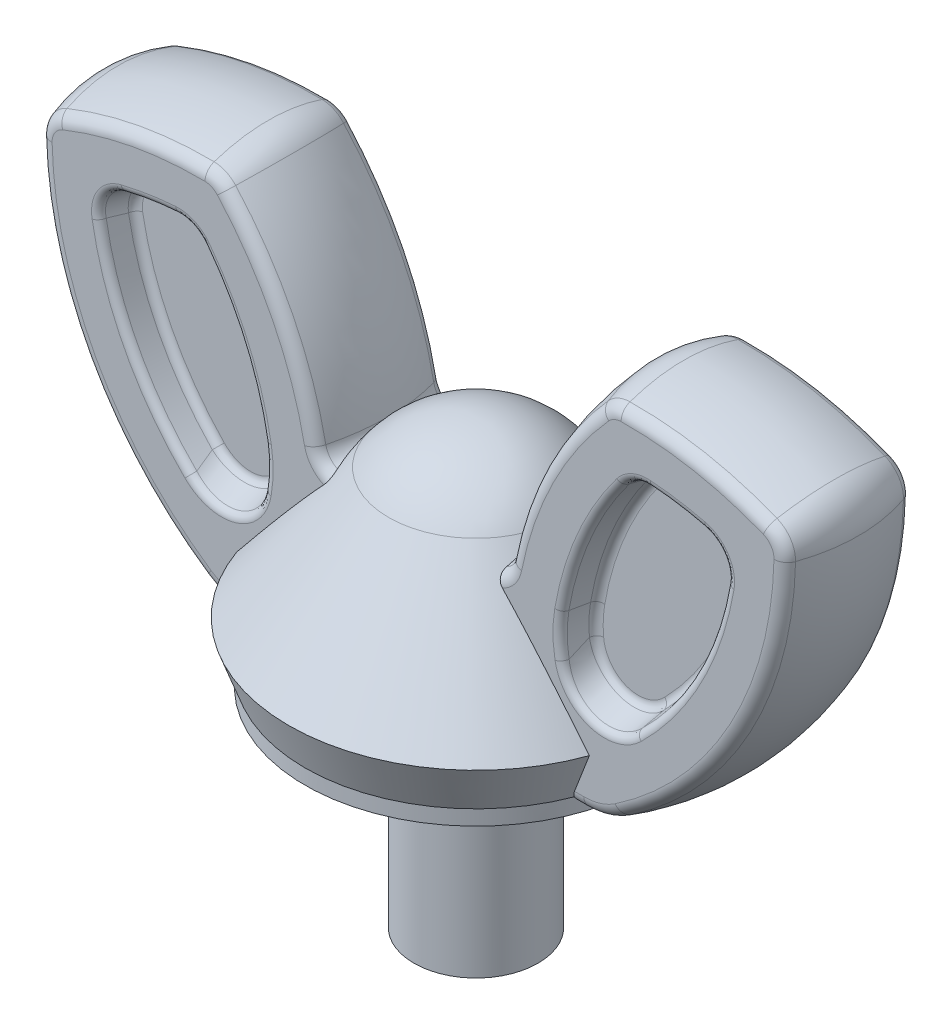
SolidWorks part; units mm, degrees
ref_plane "Front Plane" through (0, 0, 0) normal (0, 0, 1) x (1, 0, 0)
ref_plane "Top Plane" through (0, 0, 0) normal (0, 1, 0) x (1, 0, 0)
ref_plane "Right Plane" through (0, 0, 0) normal (1, 0, 0) x (0, 0, -1)
other "Configuration Table"
sketch "Sketch1" plane through (0, 0, 0) normal (0, 0, 1) x (1, 0, 0)
  line L0 (0, 10.7344) -> (0, 0) construction
  line L5 (4.826, 0) -> (-4.826, 0)
  line L6 (2.413, 5.08) -> (-2.413, 5.08)
  arc A11 (-2.413, 5.08) -> (-5.3975, 10.9034) centre (-13.1787, 3.2391) ccw
  arc A13 (-5.3975, 10.9034) -> (-10.795, 9.8298) centre (-6.0342, 0) ccw
  arc A24 (-10.795, 9.8298) -> (-6.0486, 0.3742) centre (0, 9.3295) ccw
  arc A26 (-4.826, 0) -> (-6.0486, 0.3742) centre (-4.826, 2.1844) cw
  arc A29 (4.826, 0) -> (6.0486, 0.3742) centre (4.826, 2.1844) ccw
  arc A34 (10.795, 9.8298) -> (6.0486, 0.3742) centre (0, 9.3295) cw
  arc A36 (5.3975, 10.9034) -> (10.795, 9.8298) centre (6.0342, 0) cw
  arc A37 (2.413, 5.08) -> (5.3975, 10.9034) centre (13.1787, 3.2391) cw
  point P19 (0, 0)
  point P27 (0, 5.08)
  point P29 (0, 5.08)
  point P44 (0, 5.08)
extrude "Extrude1" add sketch "Sketch1" along normal mid plane 3.556
fillet "Fillet4" radius 1.0922 4 edges at (10.795, 9.8298, 0) (5.3975, 10.9034, 0) (-5.3975, 10.9034, 0) (-10.795, 9.8298, 0)
sketch "Sketch2" plane through (0, 0, 1.778) normal (0, 0, 1) x (1, 0, 0)
  line L0 (0, 0) -> (0, 12.8329) construction
  line L1 (-4.826, 0) -> (4.826, 0) construction
  arc A10 (-4.1864, 4.7767) -> (-5.0416, 1.8652) centre (-7.5893, 4.1949) cw
  arc A11 (4.1864, 4.7767) -> (6.2055, 9.1212) centre (13.1787, 3.2391) cw
  arc A12 (6.2055, 9.1212) -> (8.9805, 8.634) centre (6.0342, 0) cw
  arc A13 (8.9805, 8.634) -> (5.0416, 1.8652) centre (0, 9.3295) cw
  arc A14 (4.1864, 4.7767) -> (5.0416, 1.8652) centre (7.5893, 4.1949) ccw
  arc A15 (-8.9805, 8.634) -> (-5.0416, 1.8652) centre (0, 9.3295) ccw
  arc A16 (-6.2055, 9.1212) -> (-8.9805, 8.634) centre (-6.0342, 0) ccw
  arc A17 (-4.1864, 4.7767) -> (-6.2055, 9.1212) centre (-13.1787, 3.2391) ccw
  arc A18 (-8.9805, 8.634) -> (-5.0416, 1.8652) centre (0, 9.3295) ccw
  arc A19 (-6.2055, 9.1212) -> (-8.9805, 8.634) centre (-6.0342, 0) ccw
  arc A20 (-4.1864, 4.7767) -> (-6.2055, 9.1212) centre (-13.1787, 3.2391) ccw
extrude "Cut-Extrude1" cut sketch "Sketch2" against normal blind 0.889 draft 10
fillet "Fillet1" radius 0.889 4 edges
fillet "Fillet6" radius 1.2446 2 edges
fillet "Fillet5" radius 0.3641 2 edges at (2.413, 5.08, 0) (-2.413, 5.08, 0)
fillet "Fillet3" radius 0.2223 28 edges at (7.4585, 9.011, 1.778) (7.4007, 8.8613, 0.889) (6.4621, 8.9114, 0.889) (8.6146, 8.3041, 0.889) (7.8855, 5.3103, 0.889) (4.2988, 4.3764, 0.889) (6.1282, 8.9579, 1.778) (8.7221, 8.5339, 1.778) (7.9776, 5.1471, 1.778) (4.1377, 4.1292, 1.778) (-4.2988, 4.3764, 0.889) (-7.8855, 5.3103, 0.889) (-8.5332, 8.4279, 0.889) (-7.4007, 8.8613, 0.889) (-6.1942, 8.7899, 0.889) (-4.1377, 4.1292, 1.778) (-7.9776, 5.1471, 1.778) (-8.7866, 8.4358, 1.778) (-7.4585, 9.011, 1.778) (-6.3795, 9.0717, 1.778) (4.9351, 6.7652, 0.889) (4.81, 6.8709, 1.778) (-4.9351, 6.7652, 0.889) (-4.81, 6.8709, 1.778) (4.9742, 2.938, 0.889) (5.0791, 2.5366, 1.778) (-5.2102, 2.8514, 0.889) (-5.0131, 2.5568, 1.778)
mirror "Mirror1" about plane through (0, 0, 0) normal (0, 0, 1) of "Fillet6", "Fillet3", "Fillet1", "Cut-Extrude1"
sketch "Sketch4" plane through (0, 0, 0) normal (1, 0, 0) x (0, 0, -1)
  line L1 (-1.778, 5.334) -> (1.778, 5.334)
  line L2 (-1.778, 4.4704) -> (-1.778, 5.334)
  line L4 (1.778, 0.3742) -> (1.778, 9.0918) construction
  line L6 (-1.778, 9.0918) -> (-1.778, 0.3742) construction
  line L7 (0, 5.715) -> (0, 0.381) construction
  line L9 (1.778, 4.4704) -> (1.778, 5.334)
  line L10 (-1.778, 5.08) -> (1.778, 5.08) construction
  arc A0 (-1.524, 4.826) -> (-1.778, 4.4704) centre (-1.4021, 4.4704) ccw
  arc A1 (1.524, 4.826) -> (-1.524, 4.826) centre (0, 0.381) ccw
  arc A2 (1.524, 4.826) -> (1.778, 4.4704) centre (1.4021, 4.4704) cw
  point P8 (0, 5.08)
sketch3d "3DSketch1"
  line L2 (-2.1102, 5.08, 1.778) -> (2.1102, 5.08, 1.778)
  line L3 (4.826, 0, 1.778) -> (-4.826, 0, 1.778)
  line L4 (-2.1102, 5.08, 1.778) -> (2.1102, 5.08, 1.778)
  line L5 (4.826, 0, 1.778) -> (-4.826, 0, 1.778)
  arc A15 (10.804, 9.0918, 1.778) -> (6.0486, 0.3742, 1.778) centre (0, 9.3295, 1.778) ccw
  arc A16 (10.1207, 10.1287, 1.778) -> (10.804, 9.0918, 1.778) centre (9.712, 9.1158, 1.778) ccw
  arc A17 (5.8682, 10.9207, 1.778) -> (10.1207, 10.1287, 1.778) centre (6.0342, 0, 1.778) ccw
  arc A18 (5.0743, 10.5608, 1.778) -> (5.8682, 10.9207, 1.778) centre (5.8848, 9.8287, 1.778) ccw
  arc A19 (2.4672, 5.3729, 1.778) -> (5.0743, 10.5608, 1.778) centre (13.1787, 3.2391, 1.778) ccw
  arc A20 (2.1102, 5.08, 1.778) -> (2.4672, 5.3729, 1.778) centre (2.1102, 5.4441, 1.778) ccw
  arc A21 (2.1102, 5.08, 1.778) -> (2.4672, 5.3729, 1.778) centre (2.1102, 5.4441, 1.778) ccw
  arc A22 (-5.0743, 10.5608, 1.778) -> (-2.4672, 5.3729, 1.778) centre (-13.1787, 3.2391, 1.778) ccw
  arc A23 (-5.8682, 10.9207, 1.778) -> (-5.0743, 10.5608, 1.778) centre (-5.8848, 9.8287, 1.778) ccw
  arc A24 (-10.1207, 10.1287, 1.778) -> (-5.8682, 10.9207, 1.778) centre (-6.0342, 0, 1.778) ccw
  arc A25 (-10.804, 9.0918, 1.778) -> (-10.1207, 10.1287, 1.778) centre (-9.712, 9.1158, 1.778) ccw
  arc A26 (-6.0486, 0.3742, 1.778) -> (-10.804, 9.0918, 1.778) centre (0, 9.3295, 1.778) ccw
  arc A27 (-4.826, 0, 1.778) -> (-6.0486, 0.3742, 1.778) centre (-4.826, 2.1844, 1.778) ccw
  arc A28 (6.0486, 0.3742, 1.778) -> (4.826, 0, 1.778) centre (4.826, 2.1844, 1.778) ccw
  arc A29 (10.804, 9.0918, 1.778) -> (6.0486, 0.3742, 1.778) centre (0, 9.3295, 1.778) ccw
  arc A30 (10.1207, 10.1287, 1.778) -> (10.804, 9.0918, 1.778) centre (9.712, 9.1158, 1.778) ccw
  arc A31 (5.8682, 10.9207, 1.778) -> (10.1207, 10.1287, 1.778) centre (6.0342, 0, 1.778) ccw
  arc A32 (5.0743, 10.5608, 1.778) -> (5.8682, 10.9207, 1.778) centre (5.8848, 9.8287, 1.778) ccw
  arc A33 (2.4672, 5.3729, 1.778) -> (5.0743, 10.5608, 1.778) centre (13.1787, 3.2391, 1.778) ccw
  arc A34 (-2.4672, 5.3729, 1.778) -> (-2.1102, 5.08, 1.778) centre (-2.1102, 5.4441, 1.778) ccw
  arc A35 (-2.4672, 5.3729, 1.778) -> (-2.1102, 5.08, 1.778) centre (-2.1102, 5.4441, 1.778) ccw
  arc A36 (-5.0743, 10.5608, 1.778) -> (-2.4672, 5.3729, 1.778) centre (-13.1787, 3.2391, 1.778) ccw
  arc A37 (-5.8682, 10.9207, 1.778) -> (-5.0743, 10.5608, 1.778) centre (-5.8848, 9.8287, 1.778) ccw
  arc A38 (-10.1207, 10.1287, 1.778) -> (-5.8682, 10.9207, 1.778) centre (-6.0342, 0, 1.778) ccw
  arc A39 (-10.804, 9.0918, 1.778) -> (-10.1207, 10.1287, 1.778) centre (-9.712, 9.1158, 1.778) ccw
  arc A40 (-6.0486, 0.3742, 1.778) -> (-10.804, 9.0918, 1.778) centre (0, 9.3295, 1.778) ccw
  arc A41 (-4.826, 0, 1.778) -> (-6.0486, 0.3742, 1.778) centre (-4.826, 2.1844, 1.778) ccw
  arc A42 (6.0486, 0.3742, 1.778) -> (4.826, 0, 1.778) centre (4.826, 2.1844, 1.778) ccw
  point P3 (2.1102, 5.4441, 2.1421)
  point P5 (2.1102, 5.4441, 2.1421)
  point P11 (-2.1102, 5.4441, 2.1421)
  point P13 (-2.1102, 5.4441, 2.1421)
  point P43 (0, 9.3295, -9.0286)
  point P46 (9.712, 9.1158, 0.6858)
  point P48 (6.0342, 0, -9.144)
  point P50 (5.8848, 9.8287, 0.6858)
  point P52 (13.1787, 3.2391, -9.144)
  point P58 (-13.1787, 3.2391, -9.144)
  point P60 (-5.8848, 9.8287, 0.6858)
  point P62 (-6.0342, 0, -9.144)
  point P64 (-9.712, 9.1158, 0.6858)
  point P66 (0, 9.3295, -9.0286)
  point P68 (-4.826, 2.1844, -0.4064)
  point P70 (4.826, 2.1844, -0.4064)
  point P71 (0, 9.3295, -9.0286)
  point P72 (9.712, 9.1158, 0.6858)
  point P73 (6.0342, 0, -9.144)
  point P74 (5.8848, 9.8287, 0.6858)
  point P75 (13.1787, 3.2391, -9.144)
  point P78 (-13.1787, 3.2391, -9.144)
  point P79 (-5.8848, 9.8287, 0.6858)
  point P80 (-6.0342, 0, -9.144)
  point P81 (-9.712, 9.1158, 0.6858)
  point P82 (0, 9.3295, -9.0286)
  point P83 (-4.826, 2.1844, -0.4064)
  point P84 (4.826, 2.1844, -0.4064)
  dimension "D1" = 0
sweep "Cut-Sweep2" cut profiles "Sketch4" path "3DSketch1"
sketch "Sketch3" plane through (0, 0, 0) normal (0, 0, 1) x (1, 0, 0)
  line L0 (0, 6.5903) -> (0, -11.3525) construction
  line L1 (1.7526, 0) -> (4.826, 0)
  line L2 (5.2882, 1.6933) -> (2.4672, 5.3729)
  line L4 (1.7526, 0) -> (1.7526, -6.35)
  line L5 (1.7526, -6.35) -> (0, -6.35)
  line L6 (4.826, 0) -> (4.826, 0.4233)
  line L7 (0, 6.5903) -> (0, -6.35)
  line L8 (0, 6.5903) -> (-2.4754, 6.5903) construction
  line L9 (4.826, 0.4233) -> (5.2882, 1.6933)
  arc A1 (2.4672, 5.3729) -> (0, 6.5903) centre (0, 3.4814) ccw
revolve "Revolve1" add sketch "Sketch3" angle 360 about L0
sketch "Sketch6" plane through (0, 0, 0) normal (0, 0, 1) x (1, 0, 0)
  line L0 (0, 4.5862) -> (0, -8.8633) construction
  line L2 (1.7526, -6.35) -> (1.7526, 0) construction
  line L3 (-1.7526, -6.35) -> (1.7526, -6.35) construction
  line L4 (1.7526, -5.8881) -> (2.0066, -5.8881)
  line L5 (2.0066, -5.8881) -> (2.0066, -6.604)
  line L8 (2.0066, -6.604) -> (0, -6.604)
  line L9 (0, -6.604) -> (0, -6.35)
  arc A0 (0, -6.35) -> (1.7526, -5.8881) centre (0, -2.794) ccw
  dimension "D1" = 0.254
  dimension "R" = 3.556
  dimension "D2" = 0.254
revolve "Cut-Revolve11" cut sketch "Sketch6" angle 360 about L0
sketch "Sketch5" plane through (0, 0, 0) normal (0, 0, 1) x (1, 0, 0)
  line L0 (1.7526, -0.0254) -> (1.2802, -0.2982)
  line L1 (1.2802, -0.2982) -> (1.7526, -0.5709)
  line L2 (1.7526, -0.5709) -> (1.7526, -0.0254)
  line L3 (0, 0) -> (0, -7.7715) construction
  line L6 (1.2802, -0.2982) -> (1.2802, -1.0906) construction
revolve "Cut-Revolve10" [suppressed] cut sketch "Sketch5" angle 360 about L3
pattern_linear "LPattern10" [suppressed] count 8 spacing 0.7925 along (0, -1, 0)
equation "\"D5@Sketch1\" = \"E@Sketch1\" / 2"
equation "\"D1@Sketch1\" = \"A@Sketch1\" / 4"
equation "\"D3@Sketch1\" = \"B@Sketch1\" * 9 /  10"
equation "\"D4@Sketch1\" = \"B@Sketch1\""
equation "\"D2@Sketch1\" = \"D4@Sketch1\" / 5"
equation "\"D1@Cut-Extrude1\" = \"C@Extrude1\" / 4"
equation "\"D1@Fillet1\" = \"D1@Cut-Extrude1\""
equation "\"D1@Fillet3\" = \"D1@Cut-Extrude1\" / 4"
equation "\"D2@Sketch3\" = \"G@Sketch1\" / 4"
equation "\"D3@Sketch3\" = \"E@Sketch1\""
equation "\"D1@Sketch4\" = \"C@Extrude1\" / 14"
equation "\"D1@Sketch5\" = \"d1@Sketch3\""
equation "\"D2@Sketch5\" = \"THD_MINOR@Cosmetic Thread1\""
equation "\"D3@LPattern10\" = \"pitch@Sketch5\""
equation "\"D1@LPattern10\" = \"L@Sketch3\" / \"D3@LPattern10\""
equation "\"D1@Cosmetic Thread1\" = \"L@Sketch3\""
equation "\"D2@Sketch4\" = \"D1@Sketch4\""
equation "\"D4@Sketch3\" = \"D2@Sketch3\" / 3"
equation "\"D1@Fillet4\" = \"D2@Sketch1\" /2"
equation "\"D1@Sketch2\" = \"D1@Sketch1\" / 3"
equation "\"D1@Fillet5\" = \"D1@Fillet4\" / 3"
equation "\"D1@Fillet6\" = \"D1@Fillet1\" * 1.4"
